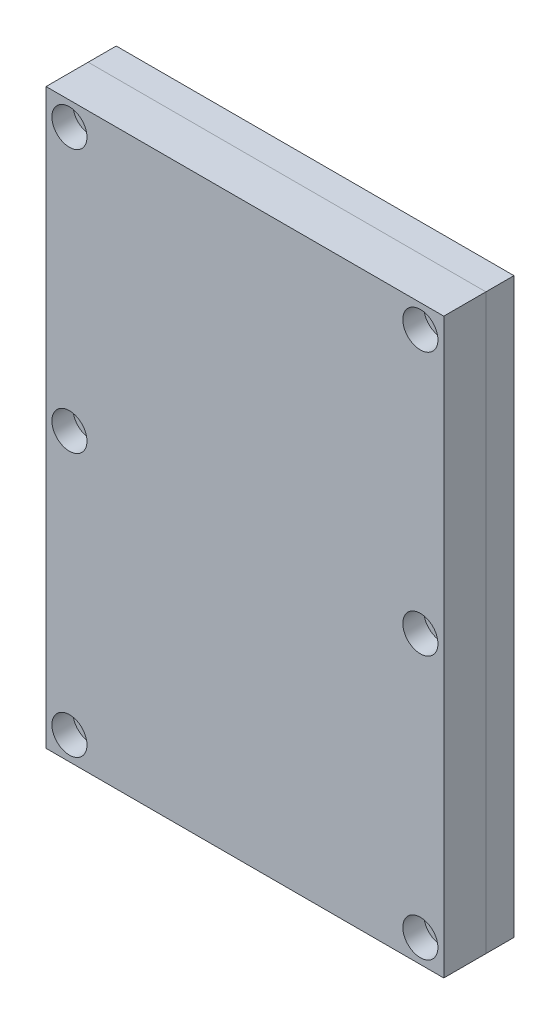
SolidWorks part; units mm, degrees
ref_plane "Alzado" through (0, 0, 0) normal (0, 0, 1) x (1, 0, 0)
ref_plane "Planta" through (0, 0, 0) normal (0, 1, 0) x (1, 0, 0)
ref_plane "Vista lateral" through (0, 0, 0) normal (1, 0, 0) x (0, 0, -1)
sketch "Croquis1" plane through (0, 0, 0) normal (0, 0, 1) x (1, 0, 0)
  line L1 (85, -122.5) -> (-85, -122.5)
  line L2 (85, -122.5) -> (85, 122.5)
  line L3 (85, 122.5) -> (-85, 122.5)
  line L4 (-85, -122.5) -> (-85, 122.5)
  line L5 (85, -122.5) -> (-85, 122.5) construction
  line L6 (85, 122.5) -> (-85, -122.5) construction
  point P0 (0, 0)
  dimension "D1" = 245
  dimension "D2" = 170
extrude "Saliente-Extruir1" add sketch "Croquis1" along normal blind 12
sketch "Croquis2" plane through (0, 0, 12) normal (0, 0, 1) x (1, 0, 0)
  line L1 (85, -122.5) -> (-85, -122.5)
  line L2 (85, -122.5) -> (85, 122.5)
  line L3 (85, 122.5) -> (-85, 122.5)
  line L4 (-85, -122.5) -> (-85, 122.5)
  line L5 (85, -122.5) -> (-85, 122.5) construction
  line L6 (85, 122.5) -> (-85, -122.5) construction
  point P0 (0, 0)
extrude "Saliente-Extruir2" add sketch "Croquis2" along normal blind 18 separate body
sketch "Croquis3" plane through (0, 0, 30) normal (0, 0, 1) x (1, 0, 0)
  line L1 (75, -112.5) -> (-75, -112.5) construction
  line L2 (75, -112.5) -> (75, 112.5) construction
  line L3 (75, 112.5) -> (-75, 112.5) construction
  line L4 (-75, -112.5) -> (-75, 112.5) construction
  line L5 (75, -112.5) -> (-75, 112.5) construction
  line L6 (75, 112.5) -> (-75, -112.5) construction
  circle A0 centre (-75, 112.5) radius 4.5
  circle A1 centre (75, 112.5) radius 4.5
  circle A2 centre (-75, 0) radius 4.5
  circle A3 centre (75, 0) radius 4.5
  circle A4 centre (-75, -112.5) radius 4.5
  circle A5 centre (75, -112.5) radius 4.5
  point P0 (0, 0)
  dimension "D3" = 9
  dimension "D1" = 225
  dimension "D2" = 150
extrude "Cortar-Extruir1" cut sketch "Croquis3" against normal through all
sketch "Croquis4" plane through (0, 0, 30) normal (0, 0, 1) x (1, 0, 0)
  circle A0 centre (-75, 112.5) radius 7.5
  circle A1 centre (75, 112.5) radius 7.5
  circle A2 centre (75, 0) radius 7.5
  circle A3 centre (-75, 0) radius 7.5
  circle A4 centre (75, -112.5) radius 7.5
  circle A5 centre (-75, -112.5) radius 7.5
  dimension "D1" = 15
extrude "Cortar-Extruir2" cut sketch "Croquis4" against normal blind 9
